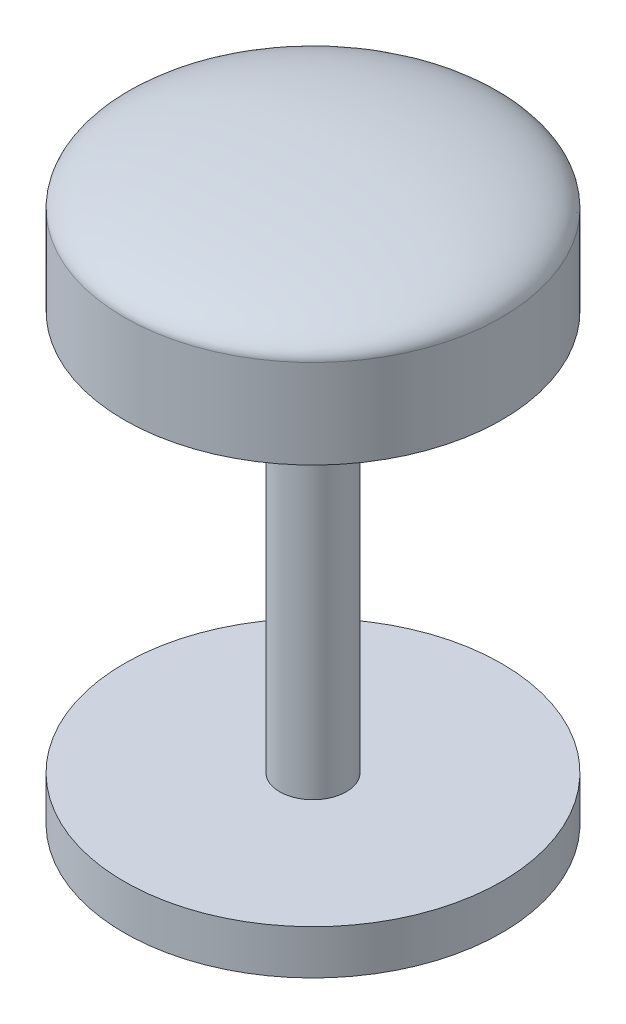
SolidWorks part; units mm, degrees
ref_plane "Front Plane" through (0, 0, 0) normal (0, 0, 1) x (1, 0, 0)
ref_plane "Top Plane" through (0, 0, 0) normal (0, 1, 0) x (1, 0, 0)
ref_plane "Right Plane" through (0, 0, 0) normal (1, 0, 0) x (0, 0, -1)
body saved out of another part "Stock-Wooden Clock Video-1"
